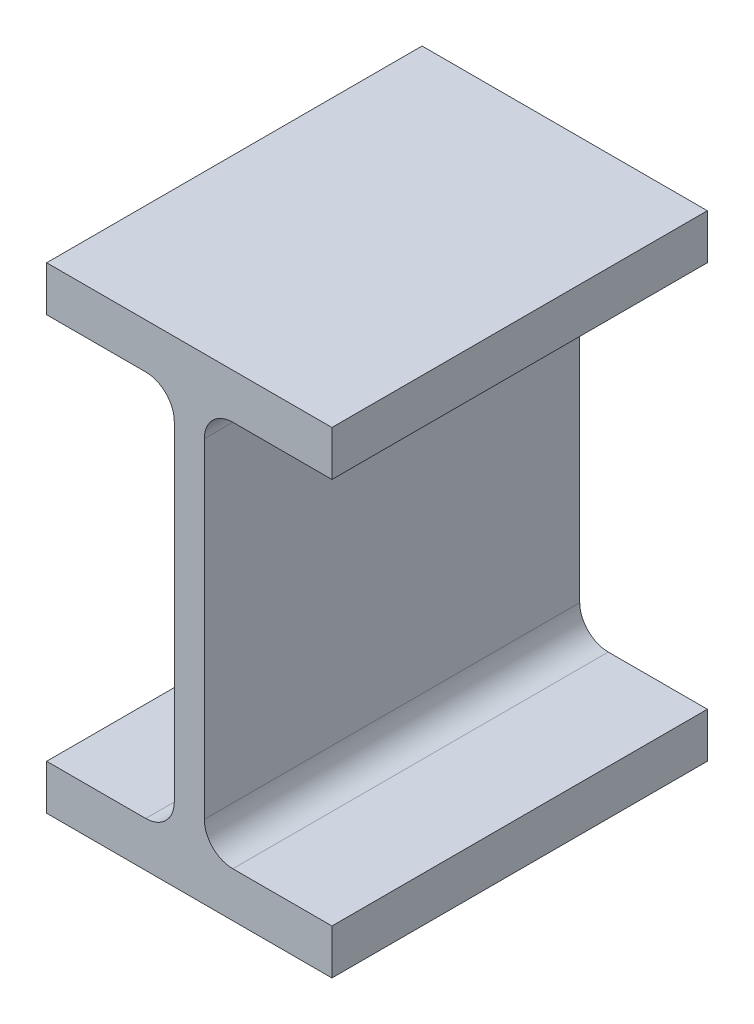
SolidWorks part; units mm, degrees
ref_plane "Front" through (0, 0, 0) normal (0, 0, 1) x (1, 0, 0)
ref_plane "Top" through (0, 0, 0) normal (0, 1, 0) x (1, 0, 0)
ref_plane "Right" through (0, 0, 0) normal (1, 0, 0) x (0, 0, -1)
sketch "Sketch1" plane through (0, 0, 0) normal (0, 0, 1) x (1, 0, 0)
  line L0 (-38, 0) -> (38, 0)
  line L1 (38, 0) -> (38, 12)
  line L2 (38, 12) -> (11.6, 12)
  line L3 (4, 19.6) -> (4, 107.4)
  line L4 (11.6, 115) -> (38, 115)
  line L5 (38, 115) -> (38, 127)
  line L6 (38, 127) -> (-38, 127)
  line L7 (-38, 127) -> (-38, 115)
  line L8 (-38, 115) -> (-11.6, 115)
  line L9 (-4, 107.4) -> (-4, 19.6)
  line L10 (-11.6, 12) -> (-38, 12)
  line L11 (-38, 12) -> (-38, 0)
  arc A0 (-11.6, 115) -> (-4, 107.4) centre (-11.6, 107.4) cw
  arc A1 (4, 107.4) -> (11.6, 115) centre (11.6, 107.4) cw
  arc A2 (11.6, 12) -> (4, 19.6) centre (11.6, 19.6) cw
  arc A3 (-4, 19.6) -> (-11.6, 12) centre (-11.6, 19.6) cw
  point P17 (4, 115)
  point P22 (0, 0)
  dimension "Fillet" = 7.6
  dimension "Flange" = 12
  dimension "Depth" = 127
  dimension "Width" = 76
  dimension "Web" = 8
extrude "Extrude1" add sketch "Sketch1" along normal mid plane 100
